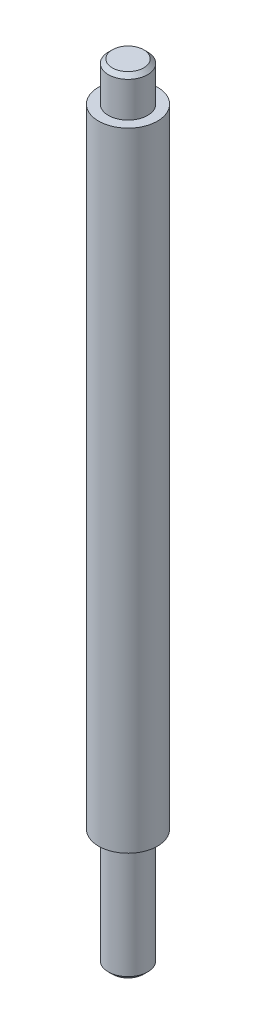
SolidWorks part; units mm, degrees
ref_plane "Face" through (0, 0, 0) normal (0, 0, 1) x (1, 0, 0)
ref_plane "Dessus" through (0, 0, 0) normal (0, 1, 0) x (1, 0, 0)
ref_plane "Droite" through (0, 0, 0) normal (1, 0, 0) x (0, 0, -1)
sketch "Esquisse1" plane through (0, 0, 0) normal (0, 0, 1) x (1, 0, 0)
  line L0 (0, 0) -> (0, 236.6775) construction
  line L1 (0, 0) -> (-10, 0)
  line L2 (-10, 0) -> (-10, 60)
  line L3 (-10, 60) -> (-15, 60)
  line L4 (-15, 60) -> (-15, 380)
  line L5 (-15, 380) -> (-10, 380)
  line L6 (-10, 380) -> (-10, 400)
  line L7 (-10, 400) -> (0, 400)
  line L8 (0, 400) -> (0, 0)
  dimension "D1" = 10
  dimension "D2" = 15
  dimension "D3" = 400
  dimension "D4" = 320
  dimension "D5" = 60
revolve "Base-Révolution" add sketch "Esquisse1" angle 360 about L0
chamfer "Chanfrein1" distance 2 angle 45
